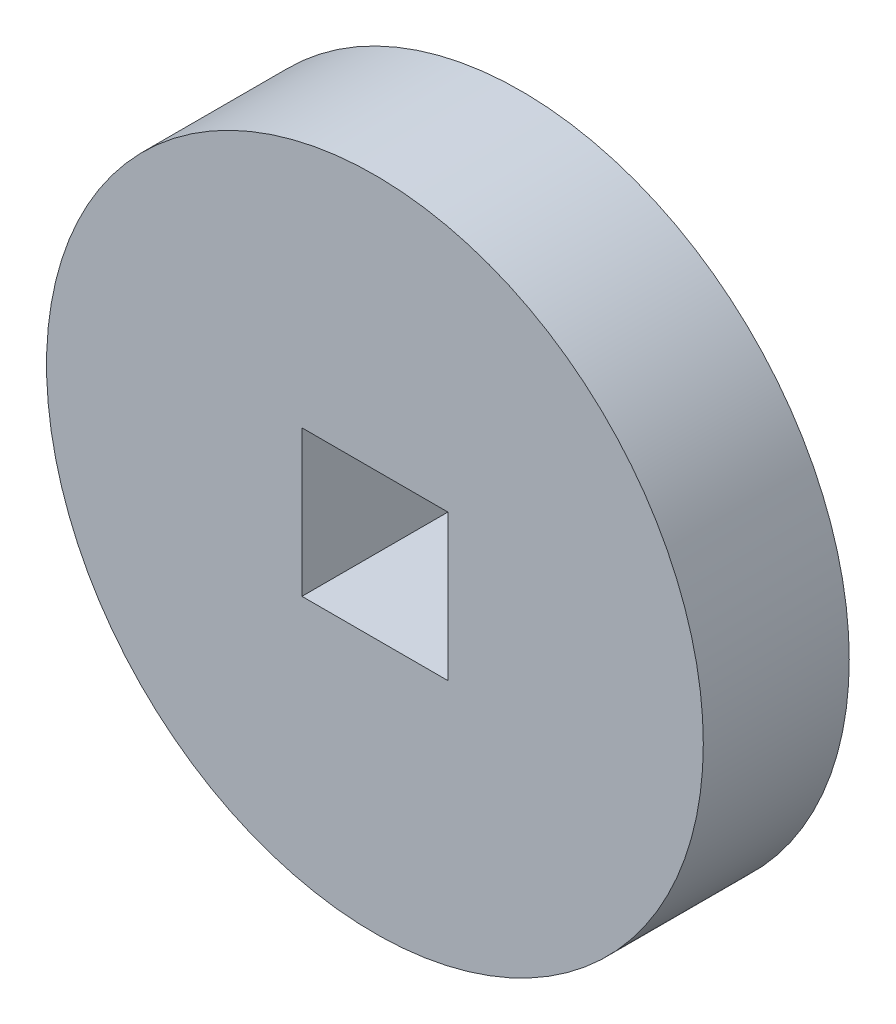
SolidWorks part; units mm, degrees
ref_plane "Front Plane" through (0, 0, 0) normal (0, 0, 1) x (1, 0, 0)
ref_plane "Top Plane" through (0, 0, 0) normal (0, 1, 0) x (1, 0, 0)
ref_plane "Right Plane" through (0, 0, 0) normal (1, 0, 0) x (0, 0, -1)
sketch "Sketch1" plane through (0, 0, 0) normal (0, 0, 1) x (1, 0, 0)
  line L1 (-3.175, 3.175) -> (3.175, 3.175)
  line L2 (-3.175, 3.175) -> (-3.175, -3.175)
  line L3 (-3.175, -3.175) -> (3.175, -3.175)
  line L4 (3.175, 3.175) -> (3.175, -3.175)
  line L5 (-3.175, 3.175) -> (3.175, -3.175) construction
  line L6 (-3.175, -3.175) -> (3.175, 3.175) construction
  circle A0 centre (0, 0) radius 14.2875
  dimension "D1" = 28.575
  dimension "D2" = 6.35
  dimension "D3" = 6.35
extrude "Boss-Extrude1" add sketch "Sketch1" along normal blind 6.35
